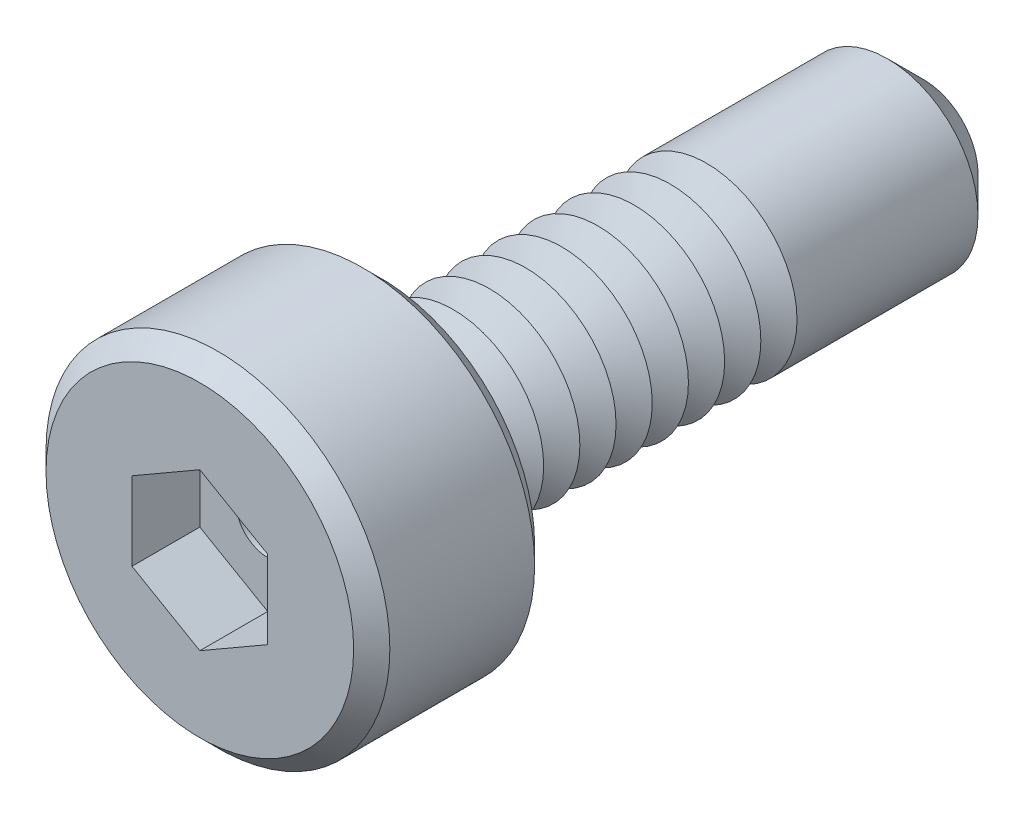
SolidWorks part; units mm, degrees
ref_plane "Front Plane" through (0, 0, 0) normal (0, 0, 1) x (1, 0, 0)
ref_plane "Top Plane" through (0, 0, 0) normal (0, 1, 0) x (1, 0, 0)
ref_plane "Right Plane" through (0, 0, 0) normal (1, 0, 0) x (0, 0, -1)
sketch "Sketch1" plane through (0, 0, 0) normal (0, 0, 1) x (1, 0, 0)
  circle A0 centre (0, 0) radius 1.9
  dimension "D1" = 3.8
extrude "Boss-Extrude1" add sketch "Sketch1" along normal blind 2
sketch "Sketch2" plane through (0, 0, 0) normal (0, 0, -1) x (-1, 0, 0)
  circle A0 centre (0, 0) radius 1
  dimension "D1" = 2
extrude "Boss-Extrude2" add sketch "Sketch2" along normal blind 6
chamfer "Chamfer1" distance 0.4 angle 45 1 edges at (-1, 0, -6)
sketch "Sketch3" plane through (0, 0, 0) normal (1, 0, 0) x (0, 0, -1)
  line L0 (-2.5121, 0) -> (4.5776, 0) construction
sketch "Sketch4" plane through (0, 0, 0) normal (1, 0, 0) x (0, 0, -1)
  line L0 (0, 1) -> (0.2, 0.6536)
  line L1 (0.2, 0.6536) -> (0.4, 1)
  line L2 (5.6, 1) -> (0, 1) construction
  line L3 (0.4, 1) -> (0, 1)
  dimension "D1" = 0.4
revolve "Cut-Revolve1" cut sketch "Sketch4" angle 360 about L0
pattern_linear "LPattern1" count 9 spacing 0.4 along (0, 0, -1) of "Cut-Revolve1"
sketch "Sketch5" plane through (0, 0, 2) normal (0, 0, 1) x (1, 0, 0)
  line L1 (0, 0.866) -> (-0.75, 0.433)
  line L2 (-0.75, 0.433) -> (-0.75, -0.433)
  line L3 (-0.75, -0.433) -> (0, -0.866)
  line L4 (0, -0.866) -> (0.75, -0.433)
  line L5 (0.75, -0.433) -> (0.75, 0.433)
  line L6 (0.75, 0.433) -> (0, 0.866)
  circle A0 centre (0, 0) radius 0.75 construction
  dimension "D1" = 1.5
extrude "Cut-Extrude1" cut sketch "Sketch5" against normal blind 0.75
sketch "Sketch6" plane through (0, 0, 1.25) normal (0, 0, 1) x (1, 0, 0)
  circle A0 centre (0, 0) radius 0.35
  dimension "D1" = 0.7
extrude "Cut-Extrude2" cut sketch "Sketch6" against normal up to surface (7.25 mm away)
chamfer "Chamfer2" distance 0.2 angle 45 2 edges at (1.9, 0, 0) (1.9, 0, 2)
